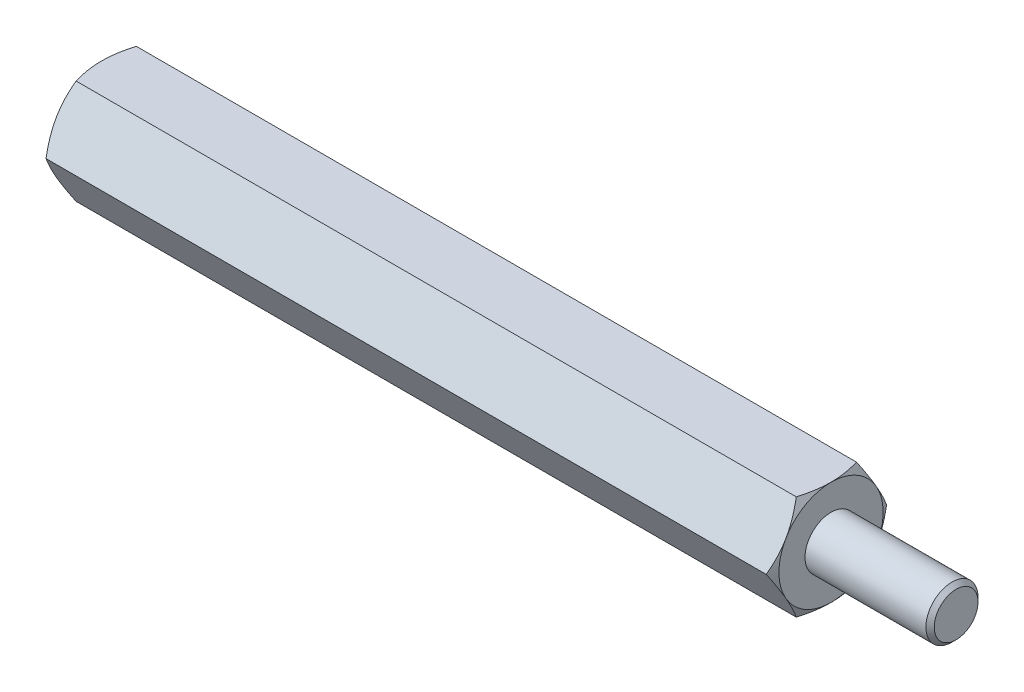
SolidWorks part; units mm, degrees
ref_plane "Front Plane" through (0, 0, 0) normal (0, 0, 1) x (1, 0, 0)
ref_plane "Top Plane" through (0, 0, 0) normal (0, 1, 0) x (1, 0, 0)
ref_plane "Right Plane" through (0, 0, 0) normal (1, 0, 0) x (0, 0, -1)
sketch "Sketch1" plane through (0, 0, 0) normal (1, 0, 0) x (0, 0, -1)
  line L1 (1.4434, 2.5) -> (-1.4434, 2.5)
  line L2 (-1.4434, 2.5) -> (-2.8868, 0)
  line L3 (-2.8868, 0) -> (-1.4434, -2.5)
  line L4 (-1.4434, -2.5) -> (1.4434, -2.5)
  line L5 (1.4434, -2.5) -> (2.8868, 0)
  line L6 (2.8868, 0) -> (1.4434, 2.5)
  circle A0 centre (0, 0) radius 2.5 construction
  dimension "D1" = 5
extrude "Extrude2" add sketch "Sketch1" along normal mid plane 35
sketch "Sketch2" plane through (0, 0, 0) normal (0, 0, 1) x (1, 0, 0)
  line L0 (-17.5, 2.5) -> (-16, 5.0981)
  line L1 (-17.5, 5.5) -> (-17.5, 2.5)
  line L3 (0, 0) -> (50000, 0) construction
  arc A0 (-16, 5.0981) -> (-17.5, 5.5) centre (-16.6962, 5.5) ccw
  dimension "D1" = 30
  dimension "D2" = 3
revolve "Cut-Revolve1" cut sketch "Sketch2" angle 360 about L3
mirror "Mirror1" about plane through (0, 0, 0) normal (1, 0, 0) of "Cut-Revolve1"
sketch "Sketch3" plane through (-17.5, 0, 0) normal (-1, 0, 0) x (0, 0, 1)
  circle A0 centre (0, 0) radius 1.05
  dimension "D1" = 2.1
extrude "Extrude3" cut sketch "Sketch3" against normal blind 6
sketch "Sketch4" plane through (0, 0, 0) normal (0, 0, 1) x (1, 0, 0)
  line L0 (-11.5, 0) -> (-11.5, 1.05)
  line L1 (17.2767, 0) -> (-17.2767, 0) construction
  line L2 (-11.5, 1.05) -> (-10.8938, 0)
  line L3 (-10.8938, 0) -> (-11.5, 0)
  line L4 (-17.5, 1.25) -> (-17.5, -1.25) construction
  point P4 (-17.5, 0)
  dimension "D1" = 30
  dimension "D2" = 1.05
  dimension "D3" = 6
revolve "Cut-Revolve2" cut sketch "Sketch4" angle 360 about L3
sketch "Sketch5" plane through (17.5, 0, 0) normal (1, 0, 0) x (0, 0, -1)
  circle A0 centre (0, 0) radius 1.25
  dimension "D1" = 2.5
extrude "Extrude4" add sketch "Sketch5" along normal blind 6
chamfer "Chamfer1" distance 0.2 angle 45 1 edges at (23.5, 0, -1.25)
equation "\"D2@Sketch4\" = \"D1@Sketch3\"/2"
